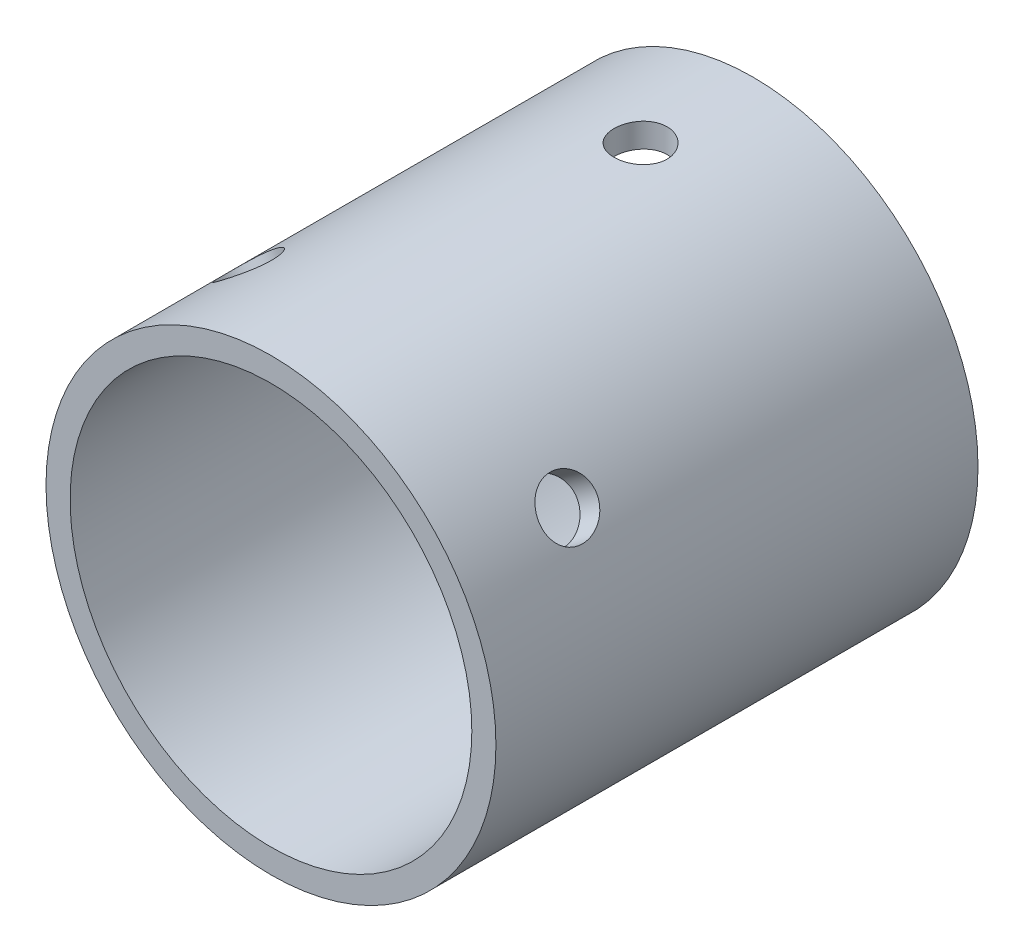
SolidWorks part; units mm, degrees
ref_plane "Front Plane" through (0, 0, 0) normal (0, 0, 1) x (1, 0, 0)
ref_plane "Top Plane" through (0, 0, 0) normal (0, 1, 0) x (1, 0, 0)
ref_plane "Right Plane" through (0, 0, 0) normal (1, 0, 0) x (0, 0, -1)
sketch "Sketch1" plane through (0, 0, 0) normal (0, 0, 1) x (1, 0, 0)
  circle A0 centre (0, 0) radius 14
  circle A1 centre (0, 0) radius 12.5
  dimension "D1" = 25
  dimension "D2" = 28
extrude "Extrude1" add sketch "Sketch1" along normal blind 30
sketch "Sketch8" plane through (0, 0, 0) normal (0, 1, 0) x (1, 0, 0)
  line L0 (0, 0) -> (0, -30) construction
  line L1 (-14, -30) -> (14, -30) construction
  line L2 (14, 0) -> (-14, 0) construction
  circle A0 centre (0, -7) radius 1.65
  dimension "D1" = 7
  dimension "D2" = 3.3
extrude "Extrude2" cut sketch "Sketch8" along normal blind 30
sketch "Sketch9" plane through (0, 0, 0) normal (0, 1, 0) x (1, 0, 0)
  line L0 (0, 0) -> (0, -30)
  line L1 (-14, -30) -> (14, -30) construction
ref_plane "Plane1" through (0, 0, 0) normal (0.8192, 0.5736, 0) x (0, 0, 1)
sketch "Sketch10" plane through (0, 0, 0) normal (0.8192, 0.5736, 0) x (0, 0, 1)
  line L0 (0, 0) -> (30, 0) construction
  line L1 (30, -14) -> (30, 14) construction
  circle A0 centre (23, 0) radius 1.75
  dimension "D1" = 7
  dimension "D2" = 3.5
extrude "Cut-Extrude1" cut sketch "Sketch10" along normal blind 22
ref_plane "Plane2" through (0, 0, 0) normal (-0.6018, 0.7986, 0) x (0, 0, 1)
sketch "Sketch11" plane through (0, 0, 0) normal (-0.6018, 0.7986, 0) x (0, 0, 1)
  line L0 (0, 0) -> (30, 0) construction
  line L1 (30, -14) -> (30, 14) construction
  circle A0 centre (23, 0) radius 1.75
  dimension "D1" = 7
  dimension "D2" = 3.5
extrude "Cut-Extrude2" cut sketch "Sketch11" along normal blind 21
